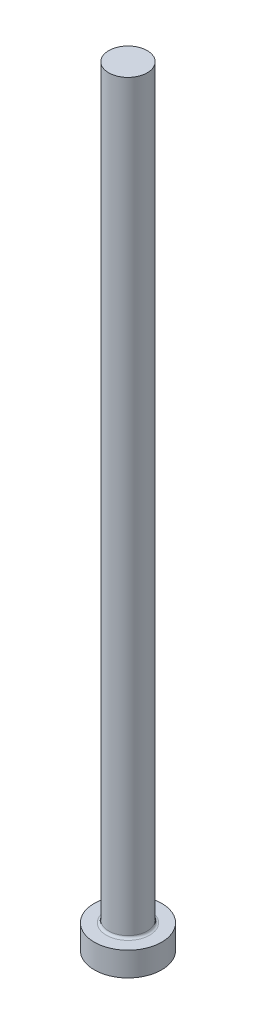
SolidWorks part; units mm, degrees
ref_plane "Plano frontal" through (0, 0, 0) normal (0, 0, 1) x (1, 0, 0)
ref_plane "Plano superior" through (0, 0, 0) normal (0, 1, 0) x (1, 0, 0)
ref_plane "Plano direito" through (0, 0, 0) normal (1, 0, 0) x (0, 0, -1)
sketch "Esboço1" plane through (0, 0, 0) normal (0, 0, 1) x (1, 0, 0)
  line L0 (0, 0) -> (7, 0)
  line L1 (7, 0) -> (7, 5)
  line L2 (7, 5) -> (4.5, 5)
  line L3 (4, 5.5) -> (4, 160)
  line L4 (4, 160) -> (0, 160)
  line L5 (0, 160) -> (0, 0) construction
  line L6 (0, 0) -> (0, 160)
  arc A0 (4.5, 5) -> (4, 5.5) centre (4.5, 5.5) cw
  dimension "D3" = 0.5
  dimension "D1" = 14
  dimension "D2" = 8
  dimension "D4" = 5
  dimension "D5" = 160
revolve "Revolução1" add sketch "Esboço1" angle 360 about L5
sketch "Esboço2"
  dimension "D1" = 0.525
  dimension "D2" = 1.225
  dimension "D3" = 0.7875
  dimension "D4" = 3.7625
wrap "Envolver1" sketch "Esboço2" wrap type deboss source sketch "Esboço2" thickness 0.1 parameters "D1"=0.1
